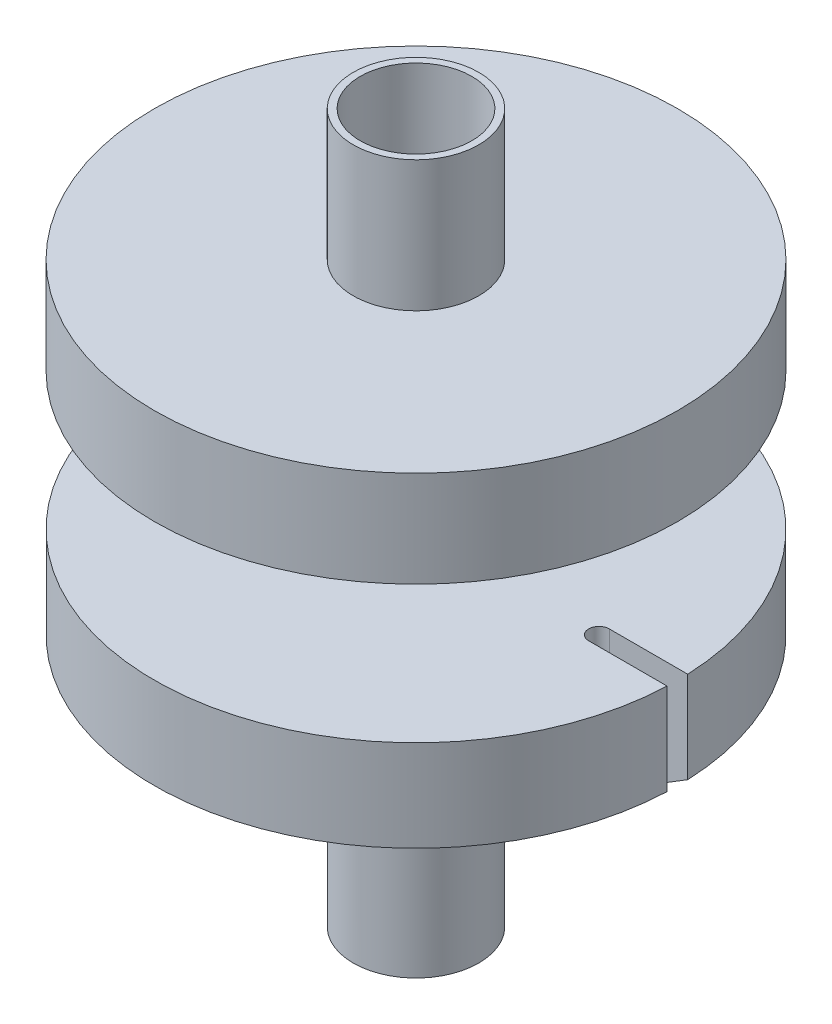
SolidWorks part; units mm, degrees
ref_plane "Front Plane" through (0, 0, 0) normal (0, 0, 1) x (1, 0, 0)
ref_plane "Top Plane" through (0, 0, 0) normal (0, 1, 0) x (1, 0, 0)
ref_plane "Right Plane" through (0, 0, 0) normal (1, 0, 0) x (0, 0, -1)
sketch "Sketch1" plane through (0, 0, 0) normal (0, 1, 0) x (1, 0, 0)
  circle A0 centre (0, 0) radius 4.572
  circle A1 centre (0, 0) radius 4.064
  dimension "D1" = 9.144
  dimension "D2" = 8.128
extrude "Boss-Extrude1" add sketch "Sketch1" along normal blind 51.6 contours A0 A1
sketch "Sketch2" plane through (0, 0, 0) normal (0, 0, 1) x (1, 0, 0)
  line L0 (-4.572, 0) -> (-4.572, 51.6)
  line L1 (4.572, 51.6) -> (4.572, 0)
  line L2 (4.572, 51.6) -> (4.572, 0)
  line L3 (-4.572, 0) -> (-4.572, 42.075)
  line L4 (4.064, 0) -> (4.064, 51.6) construction
  line L5 (-24.5151, 13.34) -> (26.3301, 13.34) construction
  line L6 (-4.064, 51.6) -> (-4.064, 0) construction
  line L7 (4.064, 0) -> (4.064, 51.6)
  line L8 (-4.572, 42.075) -> (-12.5, 42.075)
  line L9 (-4.064, 51.6) -> (-4.064, 0)
  line L10 (-12.5, 42.075) -> (-12.5, 35.075)
  line L11 (-12.5, 35.075) -> (-4.572, 35.075)
  line L12 (-4.572, 25.075) -> (-12.5, 25.075)
  line L13 (-12.5, 25.075) -> (-12.5, 13.34)
  line L15 (0, 69.8257) -> (0, -16.8871) construction
  line L16 (4.572, 51.6) -> (-4.572, 51.6) construction
  line L17 (4.572, 51.6) -> (-4.572, 51.6) construction
  line L18 (-12.5, 13.34) -> (-4.572, 13.34)
  dimension "D1" = 12.5
  dimension "D3" = 7
  dimension "D5" = 10
  dimension "D6" = 9.525
  dimension "D7" = 28.735
revolve "Revolve1" add sketch "Sketch2" angle 360 about L15
sketch "Sketch3" plane through (0, 0, 0) normal (0, 0, 1) x (1, 0, 0)
  line L2 (12.5, 13.34) -> (12.5, 25.075) construction
  line L3 (12.5, 13.34) -> (12.5, 25.075)
  line L6 (4.572, 0) -> (4.572, 13.34) construction
  line L7 (4.572, 0) -> (4.572, 13.34)
  line L8 (12.5, 25.075) -> (-12.5, 25.075) construction
  line L9 (12.5, 25.075) -> (-19.05, 25.075)
  line L10 (-12.5, 35.075) -> (12.5, 35.075) construction
  line L11 (-12.5, 35.075) -> (12.5, 35.075)
  line L12 (4.572, 25.075) -> (4.572, 35.075) construction
  line L13 (4.572, 25.075) -> (4.572, 35.075)
  line L14 (-4.572, 35.075) -> (-4.572, 25.075) construction
  line L15 (-4.572, 35.075) -> (-4.572, 25.075)
  line L16 (-4.572, 13.34) -> (-4.572, 0) construction
  line L18 (-12.5, 25.075) -> (-12.5, 13.34) construction
  line L20 (-4.572, 13.34) -> (-4.572, 0)
  line L22 (-12.5, 25.075) -> (-12.5, 13.34)
  line L24 (12.5, 42.075) -> (-12.5, 42.075) construction
  line L25 (12.5, 42.075) -> (-12.5, 42.075)
  line L26 (-19.05, 0) -> (-19.05, 42.075)
  line L27 (-19.05, 42.075) -> (-12.5, 42.075)
  line L28 (-12.5, 35.075) -> (-19.05, 35.075)
  line L29 (-4.572, 0) -> (-23.4956, 0)
  line L30 (-12.5, 13.34) -> (-19.05, 13.34)
  line L31 (0, 78.7423) -> (0, -21.5351) construction
  line L32 (12.5, 35.075) -> (12.5, 42.075)
  line L33 (-12.5, 42.075) -> (-12.5, 35.075)
  line L34 (-12.5, 42.075) -> (-12.5, 35.075)
  line L35 (12.5, 35.075) -> (12.5, 42.075)
  circle A0 centre (0, 36.85) radius 19.05 construction
  dimension "D1" = 38.1
revolve "Revolve2" add sketch "Sketch3" angle 360 about L31
sketch "Sketch4" plane through (0, 51.6, 0) normal (0, 1, 0) x (1, 0, 0)
  line L0 (-19.05, 0) -> (-4.572, 0) construction
  line L1 (0, -19.05) -> (0, -4.572) construction
  line L2 (4.572, 0) -> (19.05, 0) construction
  line L3 (0, 4.572) -> (0, 19.05) construction
  line L4 (-14.748, -1) -> (-13.7155, -1)
  line L5 (1, -15.4311) -> (1, -13.7155)
  line L6 (13.7155, -1) -> (15.4311, -1)
  line L7 (1, 13.7155) -> (1, 15.4311)
  line L8 (-14.8698, 1) -> (-13.7155, 1)
  line L9 (-1, -14.748) -> (-1, -13.7155)
  line L10 (13.7155, 1) -> (15.4311, 1)
  line L11 (-1, 13.7155) -> (-1, 14.8698)
  line L12 (6.7, 0) -> (17.05, 0) construction
  line L13 (0, 6.7) -> (0, 17.05) construction
  line L14 (0, -17.05) -> (0, -6.7) construction
  line L15 (-17.05, 0) -> (-6.7, 0) construction
  line L16 (-17.05, -1) -> (-6.7, -1) construction
  line L17 (-1, -17.05) -> (-1, -6.7) construction
  line L18 (1, -17.05) -> (1, -6.7) construction
  line L19 (1, 6.7) -> (1, 17.05) construction
  line L20 (-1, 6.7) -> (-1, 17.05) construction
  line L21 (6.7, 1) -> (17.05, 1) construction
  line L22 (6.7, -1) -> (17.05, -1) construction
  line L23 (-17.05, 1) -> (-6.7, 1) construction
  circle A0 centre (0, 0) radius 4.064 construction
  circle A1 centre (0, 0) radius 4.572
  circle A3 centre (0, 0) radius 4.064
  circle A4 centre (0, 0) radius 4.572 construction
  circle A5 centre (0, 0) radius 4.572
  arc A6 (-16.7078, -3.3987) -> (-3.3987, -16.7078) centre (0, 0) ccw
  circle A8 centre (0, 0) radius 4.572
  arc A9 (2.6511, -16.8426) -> (16.8426, -2.6511) centre (0, 0) ccw
  arc A10 (16.8426, 2.6511) -> (2.6511, 16.8426) centre (0, 0) ccw
  arc A11 (-3.2637, 16.7347) -> (-16.7347, 3.2637) centre (0, 0) ccw
  arc A12 (12.3085, 2.1797) -> (2.1797, 12.3085) centre (0, 0) ccw
  arc A16 (-3.3987, -16.7078) -> (-1, -14.748) centre (-3, -14.748) ccw
  arc A19 (-14.748, -1) -> (-16.7078, -3.3987) centre (-14.748, -3) ccw
  arc A20 (-3.2637, 16.7347) -> (-1, 14.8698) centre (-2.9, 14.8698) cw
  arc A23 (-16.7347, 3.2637) -> (-14.8698, 1) centre (-14.8698, 2.9) ccw
  arc A24 (16.8426, 2.6511) -> (15.4311, 1) centre (15.4311, 2.4289) cw
  arc A27 (1, 15.4311) -> (2.6511, 16.8426) centre (2.4289, 15.4311) cw
  arc A28 (1, -15.4311) -> (2.6511, -16.8426) centre (2.4289, -15.4311) ccw
  arc A29 (16.8426, -2.6511) -> (15.4311, -1) centre (15.4311, -2.4289) ccw
  arc A32 (-2.1797, 12.3085) -> (-12.3085, 2.1797) centre (0, 0) ccw
  arc A33 (2.1797, -12.3085) -> (12.3085, -2.1797) centre (0, 0) ccw
  arc A34 (-12.3085, -2.1797) -> (-2.1797, -12.3085) centre (0, 0) ccw
  arc A35 (-13.7155, -1) -> (-12.3085, -2.1797) centre (-13.7155, -2.4289) cw
  arc A36 (-2.1797, -12.3085) -> (-1, -13.7155) centre (-2.4289, -13.7155) cw
  arc A37 (1, -13.7155) -> (2.1797, -12.3085) centre (2.4289, -13.7155) cw
  arc A38 (12.3085, -2.1797) -> (13.7155, -1) centre (13.7155, -2.4289) cw
  arc A39 (13.7155, 1) -> (12.3085, 2.1797) centre (13.7155, 2.4289) cw
  arc A40 (2.1797, 12.3085) -> (1, 13.7155) centre (2.4289, 13.7155) cw
  arc A41 (-1, 13.7155) -> (-2.1797, 12.3085) centre (-2.4289, 13.7155) cw
  arc A42 (-12.3085, 2.1797) -> (-13.7155, 1) centre (-13.7155, 2.4289) cw
  point P55 (-12.4599, -1)
  point P71 (1, -12.4599)
  point P73 (-1, 6.625)
  point P81 (12.4599, 1)
  point P82 (6.625, 1)
  point P85 (1, 6.625)
  point P94 (6.625, -1)
  point P97 (1, -6.625)
  dimension "D6" = 2
  dimension "D7" = 1.9
  dimension "D8" = 1.4289
  dimension "D9" = 1.4289
  dimension "D10" = 25
  dimension "D3" = 1.4289
  dimension "D1" = 0
  dimension "D4" = 1
  dimension "D5" = 1
extrude "Cut-Extrude1" [suppressed] cut sketch "Sketch4" against normal through all
fillet "Fillet1" radius 0.1905 2 edges at (0, 35.075, 4.572) (0, 25.075, 4.572)
ref_plane "Coil Center" through (0, 30.075, 0) normal (0, -1, 0) x (-1, 0, 0)
sketch "Sketch5" plane through (0, 25.075, 0) normal (0, 1, 0) x (1, 0, 0)
  line L0 (0, 0) -> (5.322, 0) construction
  line L1 (13.322, 0.75) -> (19.0352, 0.75)
  line L2 (13.322, -0.75) -> (19.0352, -0.75)
  circle A0 centre (0, 0) radius 4.572 construction
  arc A1 (19.0352, 0.75) -> (19.0352, -0.75) centre (0, 0) cw
  circle A3 centre (0, 0) radius 4.572 construction
  circle A4 centre (5.322, 0) radius 0.75
  arc A5 (13.322, 0.75) -> (13.322, -0.75) centre (13.322, 0) ccw
  circle A6 centre (0, 0) radius 19.05 construction
  arc A7 (19.0352, 0.75) -> (19.0352, -0.75) centre (0, 0) ccw construction
  dimension "D2" = 1.5
  dimension "D3" = 8
extrude "Cut-Extrude2" cut sketch "Sketch5" against normal up to next
chamfer "Chamfer1" distance 8.255 distance2 5.08 1 edges at (-19.05, 13.34, 0)
ref_plane "Plane1" through (19.05, 0, 0) normal (1, 0, 0) x (0, 0, -1)
sketch "Sketch6" plane through (19.05, 0, 0) normal (1, 0, 0) x (0, 0, -1)
  line L0 (-0.75, 13.34) -> (0.75, 13.34) construction
  line L1 (-0.75, 13.34) -> (0.75, 13.34)
  line L2 (-0.75, 14.09) -> (-0.75, 13.34)
  line L3 (0.75, 13.34) -> (0.75, 14.09)
  arc A0 (0.75, 14.09) -> (-0.75, 14.09) centre (0, 14.09) ccw
extrude "Cut-Extrude3" cut sketch "Sketch6" against normal up to surface (13.728 mm away)
